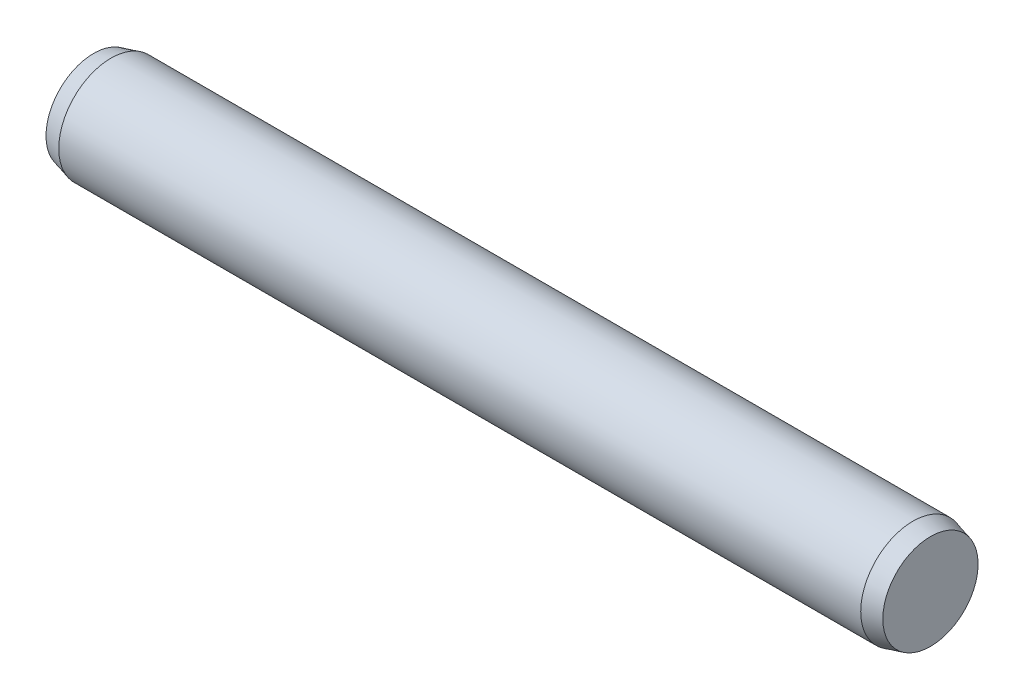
SolidWorks part; units mm, degrees
ref_plane "Plane1" through (0, 0, 0) normal (0, 0, 1) x (1, 0, 0)
ref_plane "Plane2" through (0, 0, 0) normal (0, 1, 0) x (1, 0, 0)
ref_plane "Plane3" through (0, 0, 0) normal (1, 0, 0) x (0, 0, -1)
revolve "Base-Revolve" add sketch "Sketch1" angle 360 about L1
sketch "Sketch1" plane through (0, 0, 0) normal (0, 0, 1) x (1, 0, 0)
  line L1 (-6.35, 0) -> (107.95, 0) construction
  line L2 (0, 0) -> (24, 0)
  line L3 (24, 0) -> (24, 1.366)
  line L4 (24, 1.366) -> (23.5, 1.5)
  line L5 (23.5, 1.5) -> (0.5, 1.5)
  line L6 (0, 1.366) -> (0, 0)
  line L7 (0, 1.366) -> (0.5, 1.5)
  dimension "D1" = 0.5
  dimension "D2" = 15
  dimension "D3" = 15
  dimension "Diameter" = 3
  dimension "Length" = 24
  dimension "Chamfer_len" = 0.5
equation "\"D3@Sketch1\" = 15.0"
equation "\"D1@Sketch1\" = \"Chamfer_len@Sketch1\""
equation "\"D2@Sketch1\" = \"D3@Sketch1\""
